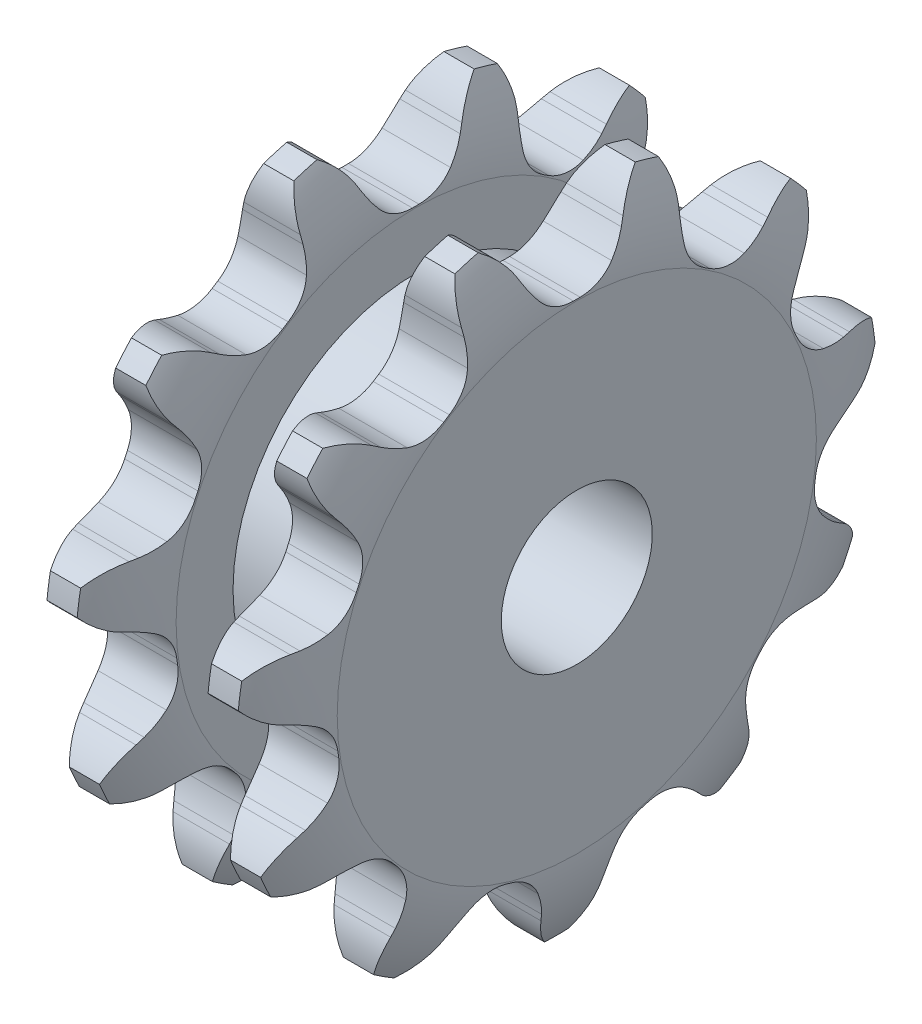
SolidWorks part; units mm, degrees
ref_plane "Plane1" through (0, 0, 0) normal (0, 0, 1) x (1, 0, 0)
ref_plane "Plane2" through (0, 0, 0) normal (0, 1, 0) x (1, 0, 0)
ref_plane "Plane3" through (0, 0, 0) normal (1, 0, 0) x (0, 0, -1)
sketch "Clipboard" plane through (0, 0, 0) normal (0, 1, 0) x (1, 0, 0)
  line L0 (0, 0) -> (6.2333, -1.2116)
  line L1 (-15, 0) -> (100, 0) construction
  line L2 (0, 0) -> (-0.5301, 0.5991)
  line L3 (0, 0) -> (-2.9891, 1.1425)
  line L4 (0, 0) -> (3.043, 0.5915)
  line L5 (0, 0) -> (-89.0105, -33.1983)
  line L6 (0, 0) -> (-7.6265, -5.1456)
  line L7 (-0.5301, 0.5991) -> (92.0355, 21.9696)
  line L8 (-76.2, 38.1) -> (-75.2, 38.1)
  line L9 (-73.2358, 39.4872) -> (-73.0836, 39.4947)
  line L10 (-73.0533, 76.1892) -> (-66.6533, 76.1892)
  circle A0 centre (0, 0) radius 1.651
  circle A1 centre (0, 0) radius 4
  circle A2 centre (0, 0) radius 4
sketch "BasProSke" plane through (0, 0, 0) normal (0, 1, 0) x (1, 0, 0)
  line L0 (-10, 0) -> (60, 0) construction
  line L1 (0, 0) -> (0, 9.5181)
  line L2 (0, 0) -> (9.2, 0)
  line L3 (9.2, 0) -> (9.2, 9.5181)
  line L4 (8.4, 12.7181) -> (0.8, 12.7181)
  arc A0 (0, 9.5181) -> (0.8, 12.7181) centre (6.8, 9.5181) cw
  arc A1 (9.2, 9.5181) -> (8.4, 12.7181) centre (2.4, 9.5181) ccw
revolve "Base-Revolve" add sketch "BasProSke" angle 360 about L0
sketch "GrvSke" plane through (0, 0, 0) normal (0, 1, 0) x (1, 0, 0)
  line L0 (2.8, 9.5181) -> (2.8, 7.2571)
  line L1 (2.8, 7.2571) -> (6.4, 7.2571)
  line L2 (6.4, 7.2571) -> (6.4, 9.5181)
  line L3 (2, 12.7181) -> (7.2, 12.7181)
  line L4 (4.6, 0) -> (4.6, 52.07) construction
  line L5 (-10, 0) -> (60, 0) construction
  line L6 (0, 0) -> (35.56, 0) construction
  arc A0 (6.4, 9.5181) -> (7.2, 12.7181) centre (13.2, 9.5181) cw
  arc A1 (2.8, 9.5181) -> (2, 12.7181) centre (-4, 9.5181) ccw
revolve "Groove" cut sketch "GrvSke" angle 360 about L6
pattern_linear "Grooves" [suppressed]
sketch "TooCutSke" plane through (0, 0, 0) normal (1, 0, 0) x (0, 0, -1)
  line L0 (1.9692, 10.9762) -> (2.1109, 11.2478)
  line L1 (0, 0) -> (0, 107) construction
  line L2 (0.2483, 11.2688) -> (-2.0258, 11.2688) construction
  line L4 (0.1322, 12.3974) -> (0.1322, 8.6148) construction
  line L5 (0.1322, 9.5714) -> (-0.1322, 9.5714)
  line L6 (-1.9692, 10.9762) -> (-2.1109, 11.2478)
  arc A0 (1.4237, 10.1675) -> (1.9692, 10.9762) centre (-1.8779, 12.9828) ccw
  arc A1 (1.4237, 10.1675) -> (0.1322, 9.5714) centre (0.1322, 11.2688) cw
  arc A2 (2.1109, 11.2478) -> (4.5677, 12.7373) centre (4.5677, 9.9664) cw
  arc A3 (-0.1322, 9.5714) -> (-1.4237, 10.1675) centre (-0.1322, 11.2688) cw
  arc A4 (-1.4237, 10.1675) -> (-1.9692, 10.9762) centre (1.8779, 12.9828) cw
  arc A5 (-2.1109, 11.2478) -> (-4.5677, 12.7373) centre (-4.5677, 9.9664) ccw
  arc A6 (4.5677, 12.7373) -> (-4.5677, 12.7373) centre (0, 0) ccw
extrude "ToothCut" cut sketch "TooCutSke" along normal through all
pattern_circular "TeethCuts" count 11 every 32.727 about axis through (-10, 0, 0) along (1, 0, 0) of "ToothCut"
sketch "HubNeaOneSke" plane through (0, 0, 0) normal (-1, 0, 0) x (0, 0, 1)
  circle A0 centre (0, 0) radius 4
extrude "HubNearOne" [suppressed] add sketch "HubNeaOneSke" along normal blind 85.8005
sketch "HubNeaBotSke" plane through (0, 0, 0) normal (-1, 0, 0) x (0, 0, 1)
  circle A0 centre (0, 0) radius 4
extrude "HubNearBoth" [suppressed] add sketch "HubNeaBotSke" along normal blind 42.9002
ref_plane "FarPln" through (9.2, 0, 0) normal (1, 0, 0) x (0, 0, -1)
sketch "HubFarSke" plane through (9.2, 0, 0) normal (1, 0, 0) x (0, 0, -1)
  circle A0 centre (0, 0) radius 4
extrude "HubFar" [suppressed] add sketch "HubFarSke" along normal blind 42.9002
sketch "BorSke" plane through (0, 0, 0) normal (1, 0, 0) x (0, 0, -1)
  circle A0 centre (0, 0) radius 3
extrude "Bore" cut sketch "BorSke" along normal mid plane 190.001
sketch "KeySke" plane through (0, 0, 0) normal (1, 0, 0) x (0, 0, -1)
  line L0 (-1, 0) -> (-1, 4)
  line L1 (-1, 4) -> (1, 4)
  line L2 (1, 4) -> (1, 0)
  line L3 (0, 0) -> (0, 34) construction
  line L4 (-1, 0) -> (1, 0)
extrude "Keyway" [suppressed] cut sketch "KeySke" along normal mid plane 190.001
pattern_circular "Keyway2" [suppressed] count 2 every 90 about axis through (-10, 0, 0) along (1, 0, 0)
equation "' \"Pitch@Clipboard\" = 6.35"
equation "' \"Num_strands@Clipboard\" = 2"
equation "' \"Num_teeth@Clipboard\" = 11"
equation "' \"Hub_dia@Clipboard\" = 8"
equation "' \"Overall_len@Clipboard\" = 95"
equation "' \"Diameter@BorSke\" = 6"
equation "' \"T_dim@Clipboard\" = 1"
equation "' \"Width@KeySke\" = 2"
equation "' \"Dr@Clipboard\" = 3.302"
equation "' \"Face_width@Clipboard\" = 2.8"
equation "' \"Chamfer_dep@Clipboard\" = 3.2"
equation "' \"Chamfer_wid@Clipboard\" = 0.8"
equation "' \"Transv_pitch@Clipboard\" = 6.4"
equation "' \"Show_teeth@Clipboard\" = 11"
equation "\"Num_teeth@Clipboard\" = int( \"Num_teeth@Clipboard\" )"
equation "\"Num_teeth@Clipboard\" = ((sgn( \"Num_teeth@Clipboard\" - 5.0)+1)*( \"Num_teeth@Clipboard\" - 5.0))/2 +5.0"
equation "\"Num_teeth@Clipboard\" = ((sgn( \"Num_teeth@Clipboard\" - 200.0)-1)*( \"Num_teeth@Clipboard\" - 200.0))/-2 +200.0"
equation "\"MHD@Clipboard\" = \"Pitch@Clipboard\" * (1.0 / tan(3.14159265 / \"Num_teeth@Clipboard\" ) - 1.0) - 0.762"
equation "\"Thickness@Clipboard\"  = \"Face_width@Clipboard\" + (\"Num_strands@Clipboard\" - 1) * \"Transv_pitch@Clipboard\""
equation "\"OAL@Clipboard\" = \"Thickness@Clipboard\""
equation "\"MHD@Clipboard\" = ((sgn( \"MHD@Clipboard\" - \"Hub_dia@Clipboard\" )-1)*( \"MHD@Clipboard\" - \"Hub_dia@Clipboard\" ))/-2+ \"Hub_dia@Clipboard\""
equation "\"OAL@Clipboard\" = ((sgn( \"OAL@Clipboard\" - \"Overall_len@Clipboard\" )+1)*( \"OAL@Clipboard\" - \"Overall_len@Clipboard\" ))/2 + \"Overall_len@Clipboard\" + 0.0005"
equation "\"Num_teeth@TeethCuts\" = int( \"Show_teeth@Clipboard\" ) + 1"
equation "\"Num_teeth@TeethCuts\" = ((sgn( \"Num_teeth@TeethCuts\" - \"Num_teeth@Clipboard\" )-1)*( \"Num_teeth@TeethCuts\" - \"Num_teeth@Clipboard\" ))/-2+ \"Num_teeth@Clipboard\""
equation "\"Num_teeth@TeethCuts\" = ((sgn( \"Num_teeth@TeethCuts\" - 2.0)+1)*( \"Num_teeth@TeethCuts\" - 2.0))/2 +2.0"
equation "\"Angle@TeethCuts\" = 360.0 / \"Num_teeth@Clipboard\""
equation "\"Pitch_radius@TooCutSke\" = ( \"Pitch@Clipboard\" / 2.0) / sin(3.14159265 / \"Num_teeth@Clipboard\" )  'ma"
equation "\"Half_U@TooCutSke\" = 0.5 * (0.07 * (\"Pitch@Clipboard\" - \"Dr@Clipboard\") + 0.051)"
equation "\"R@TooCutSke\"  = \"Dr@Clipboard\" * 0.5025 + 0.0381"
equation "\"A@TooCutSke\" = 35.0 + (60.0 / \"Num_teeth@Clipboard\")"
equation "\"E@TooCutSke\"  = \"Dr@Clipboard\" * 1.3025 + 0.0381"
equation "\"B@TooCutSke\"  = 18.0 - (56.0 / \"Num_teeth@Clipboard\" )"
equation "\"W@TooCutSke\" = 1.4 * \"Dr@Clipboard\" * cos(3.14159265 / \"Num_teeth@Clipboard\" ) + \"Half_U@TooCutSke\""
equation "\"V@TooCutSke\" = 1.4 * \"Dr@Clipboard\" * sin(3.14159265 / \"Num_teeth@Clipboard\" )"
equation "\"Diameter@BasProSke\" = 2.0 * ( (0.3 * \"Pitch@Clipboard\" ) +  \"Pitch@Clipboard\" / 2.0 / tan(3.14159265 / \"Num_teeth@Clipboard\" ))"
equation "\"Thickness@BasProSke\"  = \"Thickness@Clipboard\""
equation "\"G1@BasProSke\" =  \"Chamfer_wid@Clipboard\""
equation "\"G2@BasProSke\" =  \"Chamfer_wid@Clipboard\""
equation "\"H1@BasProSke\" =  \"Chamfer_dep@Clipboard\""
equation "\"H2@BasProSke\" =  \"Chamfer_dep@Clipboard\""
equation "\"Diameter@GrvSke\" = \"Diameter@BasProSke\""
equation "\"G1@GrvSke\" = \"Chamfer_wid@Clipboard\""
equation "\"H1@GrvSke\" = \"Chamfer_dep@Clipboard\""
equation "\"Grv_diam@GrvSke\" =  \"Pitch@Clipboard\" * (1.0 / tan(3.14159265 / \"Num_teeth@Clipboard\" ) - 1.0) - 0.762"
equation "\"Grv_width@GrvSke\" =  \"Transv_pitch@Clipboard\" - \"Face_width@Clipboard\""
equation "\"Offset@GrvSke\" = \"Grv_width@GrvSke\" / 2.0 + \"Face_width@Clipboard\""
equation "\"Offset@Grooves\" = \"Transv_pitch@Clipboard\""
equation "\"Num_grvs@Grooves\" = \"Num_strands@Clipboard\""
equation "\"Num_grvs@Grooves\" = \"Num_grvs@Grooves\" - 1 * sgn( \"Num_grvs@Grooves\" -1)"
equation "\"Diameter@HubNeaOneSke\" = \"MHD@Clipboard\""
equation "\"Length@HubNearOne\" = \"OAL@Clipboard\" - \"Thickness@BasProSke\""
equation "\"Diameter@HubNeaBotSke\" = \"MHD@Clipboard\""
equation "\"Length@HubNearBoth\" = ( \"OAL@Clipboard\" - \"Thickness@BasProSke\" ) / 2.0"
equation "\"Thickness@FarPln\" = \"Thickness@BasProSke\""
equation "\"Diameter@HubFarSke\" = \"MHD@Clipboard\""
equation "\"Length@HubFar\" = ( \"OAL@Clipboard\" - \"Thickness@BasProSke\" ) / 2.0"
equation "\"D1@Bore\" = \"OAL@Clipboard\" * 2.0"
equation "\"D1@Keyway\" = \"OAL@Clipboard\" * 2.0"
equation "\"Offset@KeySke\" = \"T_dim@Clipboard\" + \"Diameter@BorSke\" / 2.0"
